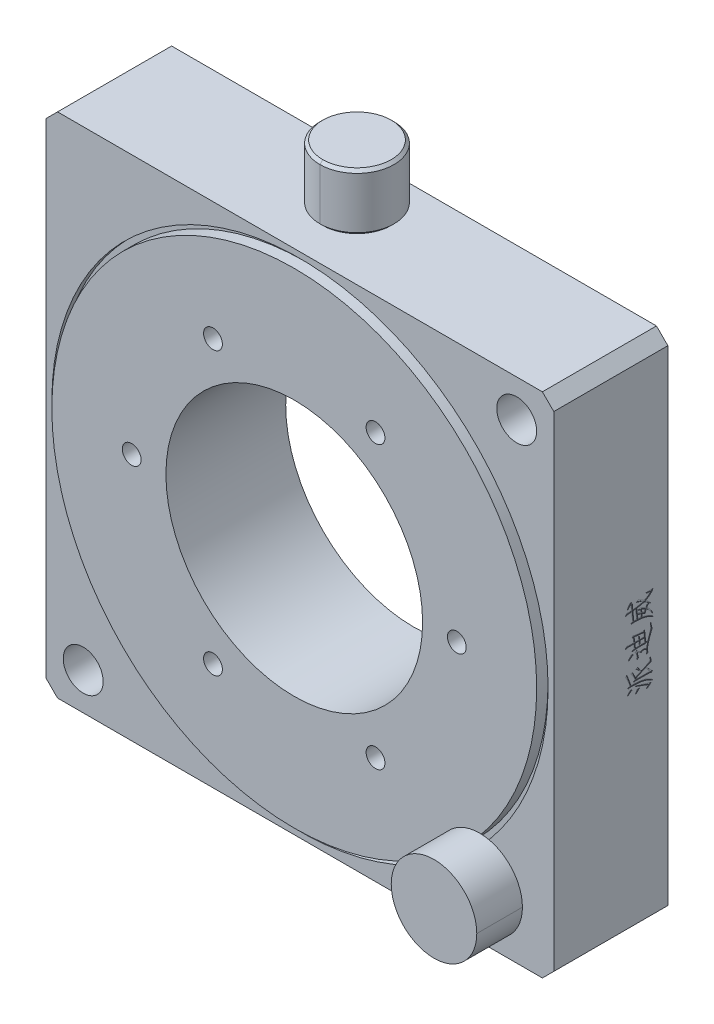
SolidWorks part; units mm, degrees
ref_plane "前视基准面" through (0, 0, 0) normal (0, 0, 1) x (1, 0, 0)
ref_plane "上视基准面" through (0, 0, 0) normal (0, 1, 0) x (1, 0, 0)
ref_plane "右视基准面" through (0, 0, 0) normal (1, 0, 0) x (0, 0, -1)
imported_body "输入1"
chamfer "倒角2" distance 2 angle 45
sketch "草图2" plane through (0, 0, 21) normal (0, 0, 1) x (1, 0, 0)
  arc A1 (22.5, 0) -> (-22.5, 0) centre (0, 0) ccw construction
  arc A2 (22.5, 0) -> (-22.5, 0) centre (0, 0) ccw
  arc A3 (42.5, 0) -> (-42.5, 0) centre (0, 0) ccw
  arc A4 (-42.5, 0) -> (42.5, 0) centre (0, 0) ccw
  arc A5 (42.5, 0) -> (-42.5, 0) centre (0, 0) ccw
  arc A6 (-42.5, 0) -> (42.5, 0) centre (0, 0) ccw
  arc A7 (-22.5, 0) -> (22.5, 0) centre (0, 0) ccw construction
  arc A8 (-22.5, 0) -> (22.5, 0) centre (0, 0) ccw
  dimension "D1" = 0
extrude "凸台-拉伸1" add sketch "草图2" against normal up to surface (21 mm away)
sketch "草图3" plane through (0, 0, 21) normal (0, 0, 1) x (1, 0, 0)
  circle A0 centre (0, 0) radius 28.5 construction
  dimension "D1" = 57
hole_wizard "M4 螺纹孔1" positions "草图4" profile "草图5" tap size "M4" standard "GB"
sketch "草图4" plane through (0, 0, 21) normal (0, 0, 1) x (1, 0, 0)
  circle A0 centre (0, 0) radius 28.5 construction
  point P0 (28.5, 0)
sketch "草图5" plane through (28.5, 0, 21) normal (1, 0, 0) x (0, -1, 0)
  line L0 (0, 0) -> (0, 11.0914)
  line L1 (0, 11.0914) -> (1.65, 10.1)
  line L2 (1.65, 10.1) -> (1.65, 0)
  line L5 (1.65, 0) -> (0, 0)
  line L10 (0, 11.0914) -> (-1.65, 10.1) construction
  line L11 (0, -6.35) -> (0, 107.95) construction
  dimension "螺纹孔钻头直径" = 3.3
  dimension "螺纹孔钻头深度" = 10.1
  dimension "导头角度" = 118
pattern_circular "阵列(圆周)1" count 6 over 360 about axis through (0, 0, 0) along (0, 0, 1) of "M4 螺纹孔1"
sketch "草图6" plane through (0, 0, 20) normal (0, 0, 1) x (1, 0, 0)
  circle A0 centre (39.5, 39.5) radius 4.5383
  circle A1 centre (-39.5, -39.5) radius 4.3512
extrude "凸台-拉伸2" add sketch "草图6" against normal up to surface (20 mm away)
hole_wizard "Ø7.0 (7) 直径孔1" positions "草图7" profile "草图8" hole size "Ø7.0" standard "GB"
sketch "草图7" plane through (0, 0, 20) normal (0, 0, 1) x (1, 0, 0)
  point P2 (-38, -38)
  point P4 (38, 38)
  dimension "D1" = 38
  dimension "D2" = 38
  dimension "D3" = 38
  dimension "D4" = 38
sketch "草图8" plane through (-38, -38, 20) normal (1, 0, 0) x (0, -1, 0)
  line L0 (0, 0) -> (0, 20)
  line L1 (0, 20) -> (3.5, 20)
  line L2 (3.5, 20) -> (3.5, 0)
  line L5 (3.5, 0) -> (0, 0)
  line L11 (0, -6.35) -> (0, 107.95) construction
  dimension "通孔孔直径" = 7
  dimension "通孔孔深度" = 20
sketch "草图9" plane through (44.5, 0, 0) normal (-1, 0, 0) x (0, -1, 0)
  line L0 (-16.2017, 3.1249) -> (16.754, 3.1249) construction
  text T0 "派迪威"
extrude "切除-拉伸1" cut sketch "草图9" along normal blind 0.1
